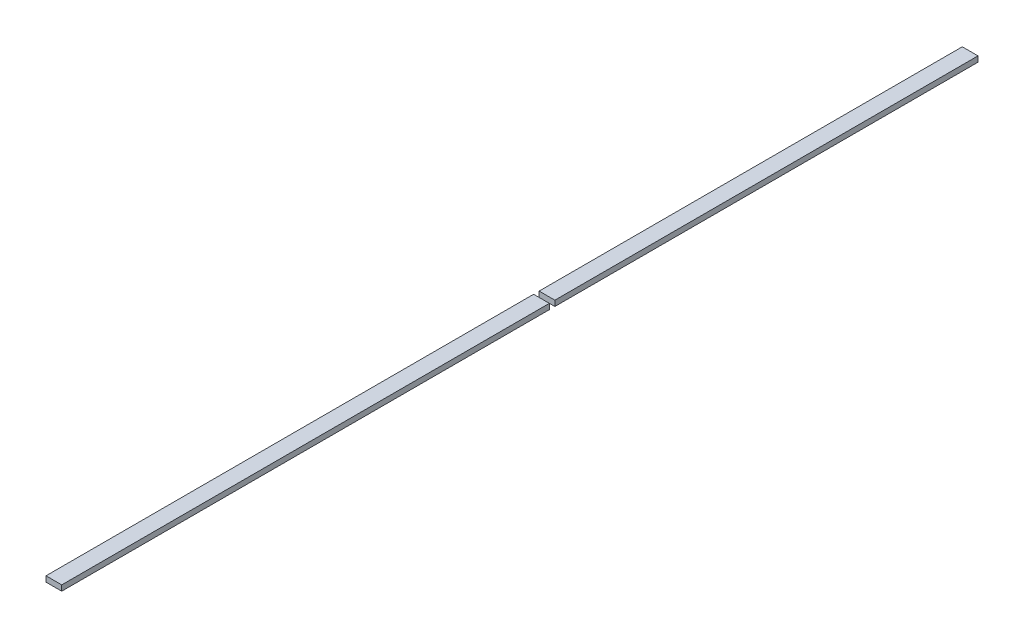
SolidWorks part; units mm, degrees
ref_plane "Front Plane" through (0, 0, 0) normal (0, 0, 1) x (1, 0, 0)
ref_plane "Top Plane" through (0, 0, 0) normal (0, 1, 0) x (1, 0, 0)
ref_plane "Right Plane" through (0, 0, 0) normal (1, 0, 0) x (0, 0, -1)
sketch "Sketch1" plane through (0, 0, 0) normal (0, 0, 1) x (1, 0, 0)
  line L1 (-20, -7) -> (20, -7)
  line L2 (-20, -7) -> (-20, 7)
  line L3 (-20, 7) -> (20, 7)
  line L4 (20, -7) -> (20, 7)
  line L5 (-20, -7) -> (20, 7) construction
  line L6 (-20, 7) -> (20, -7) construction
  dimension "D1" = 40
  dimension "D2" = 14
extrude "Boss-Extrude1" add sketch "Sketch1" along normal mid plane 2330
sketch "Sketch2" plane through (0, -7, 0) normal (0, -1, 0) x (1, 0, 0)
  line L0 (20, 1165) -> (20, -1165) construction
  line L1 (-20, -89) -> (20, -89)
  line L2 (-20, -89) -> (-20, -75)
  line L3 (-20, -75) -> (20, -75)
  line L4 (20, -89) -> (20, -75)
  line L5 (-20, -89) -> (20, -75) construction
  line L6 (-20, -75) -> (20, -89) construction
  line L7 (-20, 1165) -> (-20, -1165) construction
  line L9 (-20, -1165) -> (20, -1165) construction
  point P0 (0, -82)
  point P9 (0, -89)
  dimension "D1" = 1076
  dimension "D2" = 14
extrude "Cut-Extrude1" cut sketch "Sketch2" against normal through all
